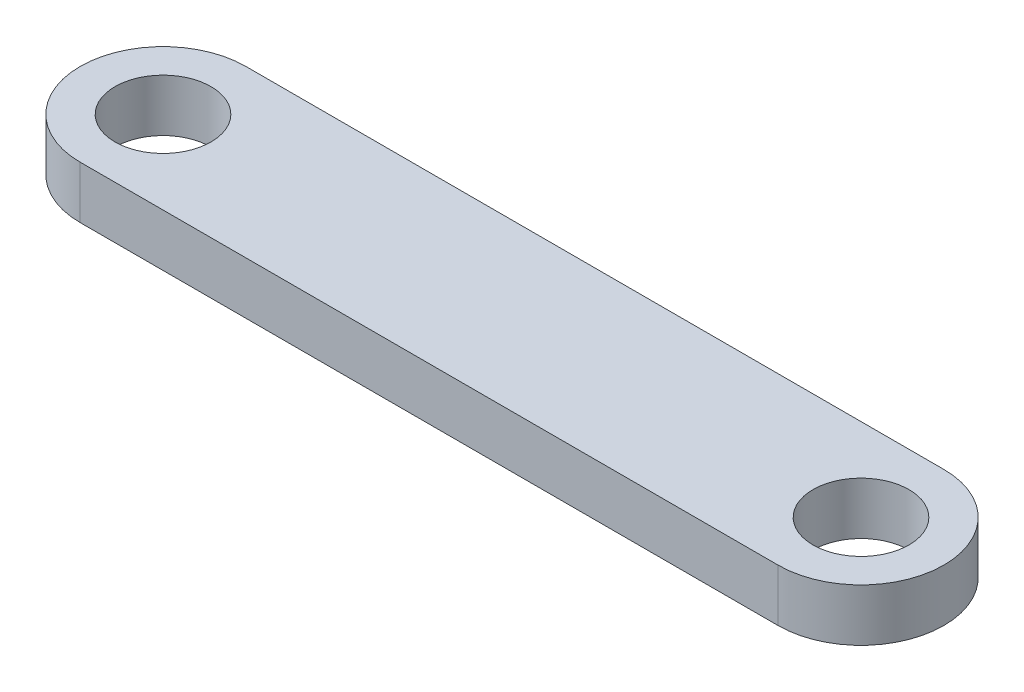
SolidWorks part; units mm, degrees
ref_plane "Front Plane" through (0, 0, 0) normal (0, 0, 1) x (1, 0, 0)
ref_plane "Top Plane" through (0, 0, 0) normal (0, 1, 0) x (1, 0, 0)
ref_plane "Right Plane" through (0, 0, 0) normal (1, 0, 0) x (0, 0, -1)
sketch "Sketch1" plane through (0, 0, 0) normal (0, 1, 0) x (1, 0, 0)
  line L1 (-20, 4.75) -> (20, 4.75)
  line L3 (-20, -4.75) -> (20, -4.75)
  arc A0 (-20, 4.75) -> (-20, -4.75) centre (-20, 0) ccw
  arc A1 (20, -4.75) -> (20, 4.75) centre (20, 0) ccw
  circle A2 centre (-20, 0) radius 2.75
  circle A3 centre (20, 0) radius 2.75
extrude "Boss-Extrude1" add sketch "Sketch1" along normal blind 3
equation "\"D4@Sketch1\"=\"D3@Sketch1\"/2"
equation "\"D6@Sketch1\"=\"D5@Sketch1\""
equation "\"D7@Sketch1\"=\"D2@Sketch1\""
